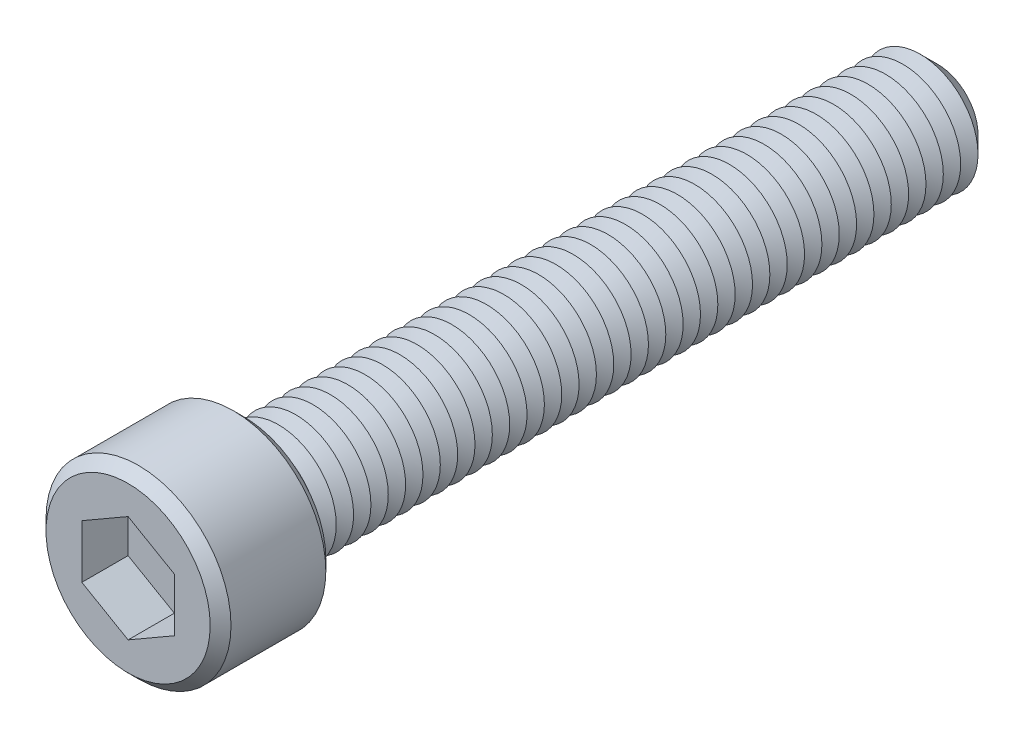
SolidWorks part; units mm, degrees
ref_plane "Front Plane" through (0, 0, 0) normal (0, 0, 1) x (1, 0, 0)
ref_plane "Top Plane" through (0, 0, 0) normal (0, 1, 0) x (1, 0, 0)
ref_plane "Right Plane" through (0, 0, 0) normal (1, 0, 0) x (0, 0, -1)
sketch "Sketch1" plane through (0, 0, 0) normal (0, 0, 1) x (1, 0, 0)
  circle A0 centre (0, 0) radius 8
  dimension "D1" = 16
extrude "Boss-Extrude1" add sketch "Sketch1" along normal blind 10
sketch "Sketch2" plane through (0, 0, 0) normal (0, 0, -1) x (-1, 0, 0)
  circle A0 centre (0, 0) radius 5
  dimension "D1" = 10
extrude "Boss-Extrude2" add sketch "Sketch2" along normal blind 60
chamfer "Chamfer1" distance 1.5 angle 45 1 edges at (-5, 0, -60)
sketch "Sketch3" plane through (0, 0, 0) normal (1, 0, 0) x (0, 0, -1)
  line L0 (-2.5121, 0) -> (4.5776, 0) construction
sketch "Sketch4" plane through (0, 0, 0) normal (1, 0, 0) x (0, 0, -1)
  line L0 (0, 5) -> (0.75, 3.701)
  line L1 (0.75, 3.701) -> (1.5, 5)
  line L2 (58.5, 5) -> (0, 5) construction
  line L3 (1.5, 5) -> (0, 5)
  dimension "D1" = 1.5
revolve "Cut-Revolve1" cut sketch "Sketch4" angle 360 about L0
pattern_linear "LPattern1" count 39 spacing 1.5 along (0, 0, -1) of "Cut-Revolve1"
sketch "Sketch5" plane through (0, 0, 10) normal (0, 0, 1) x (1, 0, 0)
  line L1 (0, 4.6188) -> (-4, 2.3094)
  line L2 (-4, 2.3094) -> (-4, -2.3094)
  line L3 (-4, -2.3094) -> (0, -4.6188)
  line L4 (0, -4.6188) -> (4, -2.3094)
  line L5 (4, -2.3094) -> (4, 2.3094)
  line L6 (4, 2.3094) -> (0, 4.6188)
  circle A0 centre (0, 0) radius 4 construction
  dimension "D1" = 8
extrude "Cut-Extrude1" cut sketch "Sketch5" against normal blind 4
sketch "Sketch6" plane through (0, 0, 6) normal (0, 0, 1) x (1, 0, 0)
  circle A0 centre (0, 0) radius 0.9
  dimension "D1" = 1.8
extrude "Cut-Extrude2" cut sketch "Sketch6" against normal up to surface (66 mm away)
chamfer "Chamfer2" distance 0.9 angle 45 2 edges at (8, 0, 0) (8, 0, 10)
